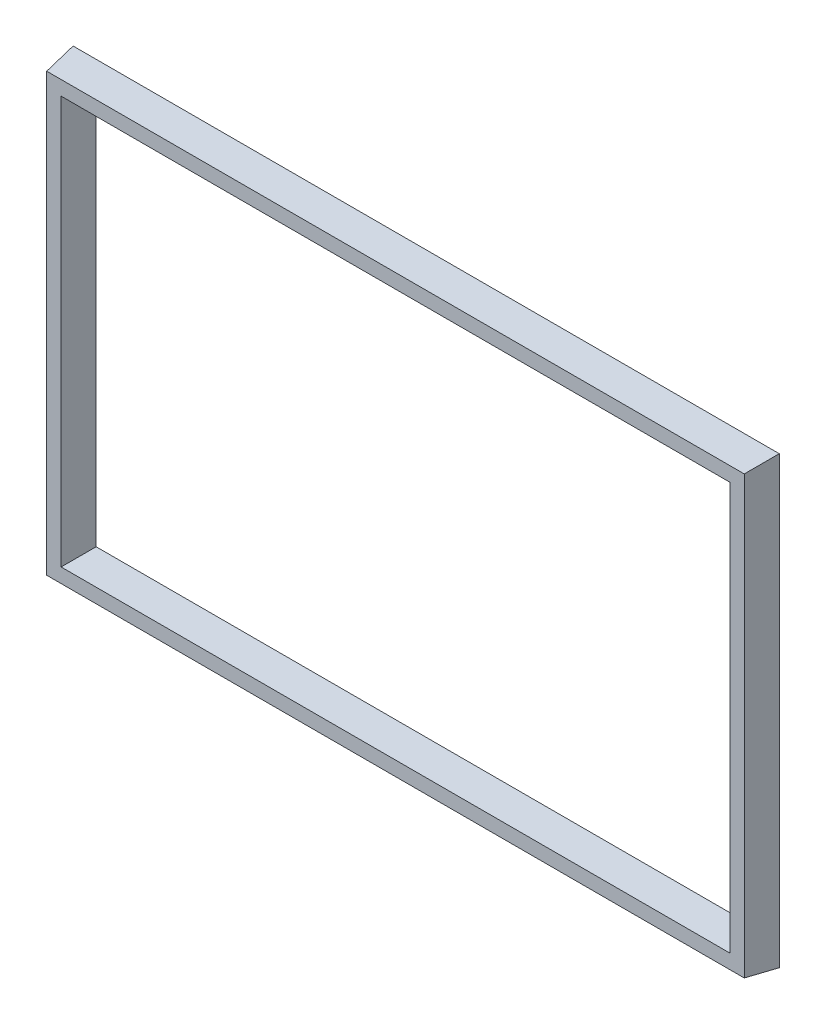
SolidWorks part; units mm, degrees
ref_plane "Front Plane" through (0, 0, 0) normal (0, 0, 1) x (1, 0, 0)
ref_plane "Top Plane" through (0, 0, 0) normal (0, 1, 0) x (1, 0, 0)
ref_plane "Right Plane" through (0, 0, 0) normal (1, 0, 0) x (0, 0, -1)
sketch "Sketch1" plane through (0, 0, 0) normal (0, 0, 1) x (1, 0, 0)
  line L8 (13.5, 0) -> (13.5, -26)
  line L9 (56.5, 0) -> (13.5, 0)
  line L10 (56.5, -26) -> (56.5, 0)
  line L11 (13.5, -26) -> (56.5, -26)
  line L16 (58, -27.5) -> (58, 1.5)
  line L17 (58, 1.5) -> (12, 1.5)
  line L18 (12, 1.5) -> (12, -27.5)
  line L19 (12, -27.5) -> (58, -27.5)
extrude "Boss-Extrude1" add sketch "Sketch1" along normal blind 2 draft 8
